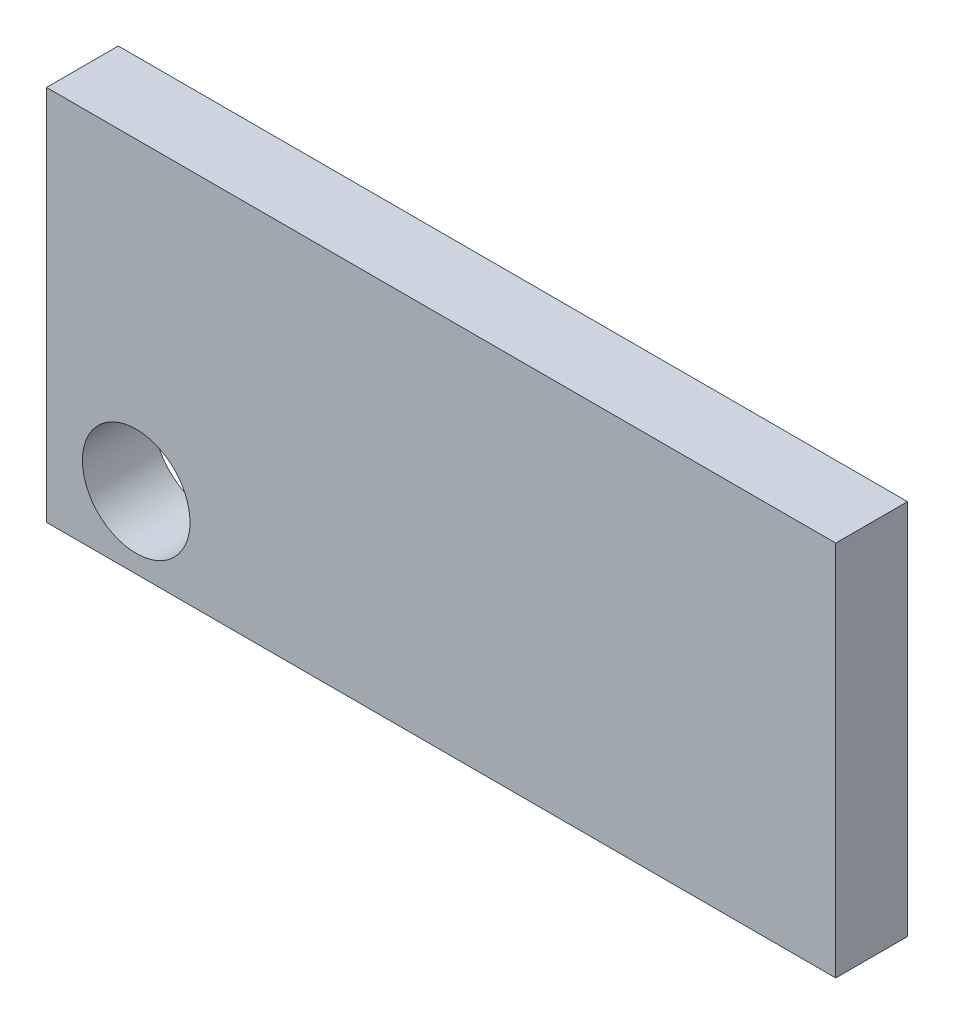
SolidWorks part; units mm, degrees
ref_plane "Front Plane" through (0, 0, 0) normal (0, 0, 1) x (1, 0, 0)
ref_plane "Top Plane" through (0, 0, 0) normal (0, 1, 0) x (1, 0, 0)
ref_plane "Right Plane" through (0, 0, 0) normal (1, 0, 0) x (0, 0, -1)
sketch "Sketch2" plane through (0, 0, 0) normal (0, 0, 1) x (1, 0, 0)
  line L1 (0, 0) -> (1117.6, 0)
  line L2 (0, 0) -> (0, 533.4)
  line L3 (0, 533.4) -> (1117.6, 533.4)
  line L4 (1117.6, 0) -> (1117.6, 533.4)
  dimension "D1" = 1117.6
  dimension "D2" = 533.4
extrude "Boss-Extrude1" add sketch "Sketch2" along normal blind 101.6
sketch "Sketch7" plane through (0, 0, 0) normal (0, 0, -1) x (-1, 0, 0)
  line L0 (0, 533.4) -> (0, 0) construction
  line L1 (0, 0) -> (-1117.6, 0) construction
  circle A0 centre (-127, 101.6) radius 76.2
  dimension "D1" = 152.4
  dimension "D2" = 127
  dimension "D3" = 101.6
extrude "Cut-Extrude1" cut sketch "Sketch7" against normal through all
sketch "Sketch8" plane through (0, 0, 0) normal (0, 0, -1) x (-1, 0, 0)
  line L0 (-1117.6, 0) -> (-1117.6, 533.4) construction
  line L1 (0, 0) -> (-1117.6, 0) construction
  circle A0 centre (-1041.4, 457.2) radius 4.8895
  dimension "D1" = 9.779
  dimension "D2" = 76.2
  dimension "D3" = 457.2
extrude "Cut-Extrude2" cut sketch "Sketch8" against normal blind 50.8
pattern_linear "LPattern1" count 10 spacing 101.6 along (-1, 0, 0) of "Cut-Extrude2"
